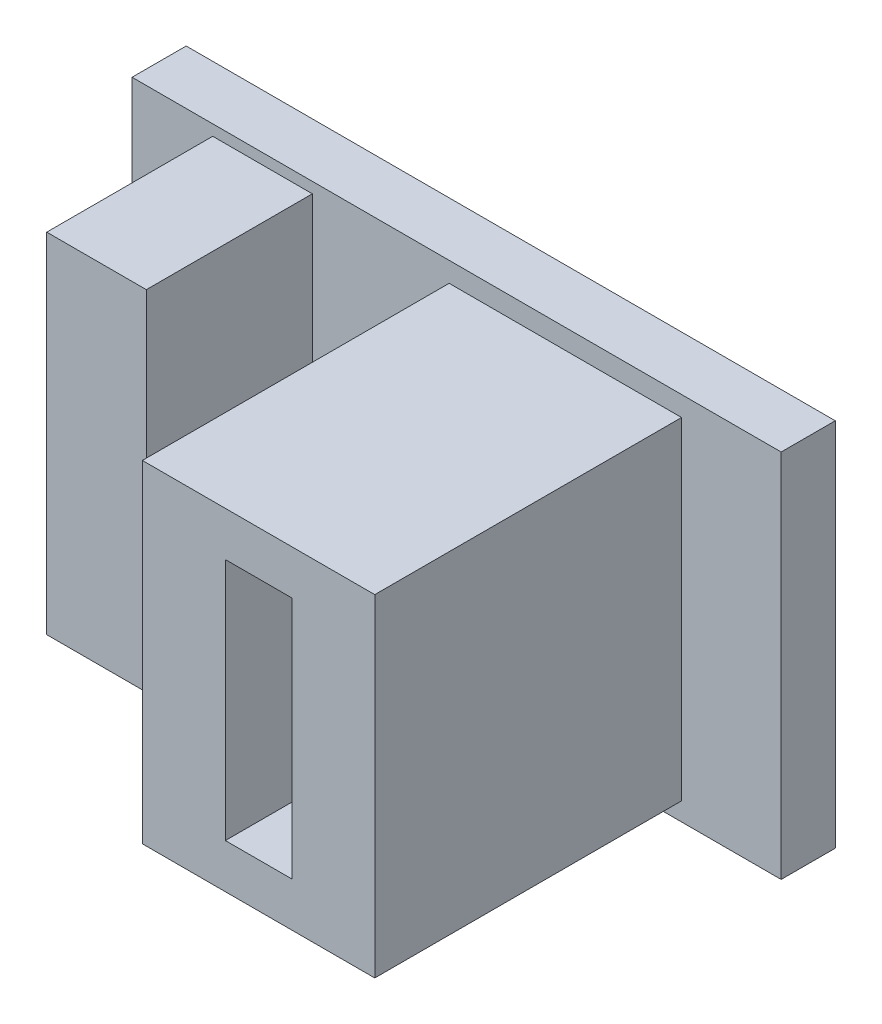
SolidWorks part; units mm, degrees
ref_plane "Front Plane" through (0, 0, 0) normal (0, 0, 1) x (1, 0, 0)
ref_plane "Top Plane" through (0, 0, 0) normal (0, 1, 0) x (1, 0, 0)
ref_plane "Right Plane" through (0, 0, 0) normal (1, 0, 0) x (0, 0, -1)
sketch "Sketch1" plane through (0, 0, 0) normal (0, 0, 1) x (1, 0, 0)
  line L1 (0, 0) -> (19.55, 0)
  line L2 (0, 0) -> (0, 11.15)
  line L3 (0, 11.15) -> (19.55, 11.15)
  line L4 (19.55, 0) -> (19.55, 11.15)
  dimension "D1" = 19.55
  dimension "D2" = 11.15
extrude "Extrude1" add sketch "Sketch1" along normal blind 1.63
sketch "Sketch2" plane through (0, 0, 1.63) normal (0, 0, 1) x (1, 0, 0)
  line L0 (19.55, 0) -> (19.55, 11.15) construction
  line L1 (16.55, 0.55) -> (9.55, 0.55)
  line L2 (16.55, 0.55) -> (16.55, 10.55)
  line L3 (16.55, 10.55) -> (9.55, 10.55)
  line L4 (9.55, 0.55) -> (9.55, 10.55)
  line L5 (0, 0) -> (19.55, 0) construction
  dimension "D1" = 10
  dimension "D2" = 7
  dimension "D3" = 3
  dimension "D4" = 0.55
extrude "Extrude2" add sketch "Sketch2" along normal blind 9.24
sketch "Sketch3" plane through (0, 0, 10.87) normal (0, 0, 1) x (1, 0, 0)
  line L0 (16.55, 10.55) -> (9.55, 10.55) construction
  line L1 (12.05, 9.215) -> (14.05, 9.215)
  line L2 (12.05, 9.215) -> (12.05, 1.885)
  line L3 (12.05, 1.885) -> (14.05, 1.885)
  line L4 (14.05, 9.215) -> (14.05, 1.885)
  line L5 (16.55, 0.55) -> (16.55, 10.55) construction
  dimension "D1" = 2
  dimension "D2" = 7.33
  dimension "D3" = 1.335
  dimension "D4" = 2.5
extrude "Cut-Extrude1" cut sketch "Sketch3" against normal blind 8.38
sketch "Sketch4" plane through (0, 0, 1.63) normal (0, 0, 1) x (1, 0, 0)
  line L0 (0, 11.15) -> (0, 0) construction
  line L1 (5.43, 10.825) -> (2.43, 10.825)
  line L2 (5.43, 10.825) -> (5.43, 0.325)
  line L3 (5.43, 0.325) -> (2.43, 0.325)
  line L4 (2.43, 10.825) -> (2.43, 0.325)
  line L5 (0, 0) -> (19.55, 0) construction
  dimension "D1" = 3
  dimension "D2" = 10.5
  dimension "D3" = 5.43
  dimension "D4" = 0.325
extrude "Extrude3" add sketch "Sketch4" along normal blind 5
